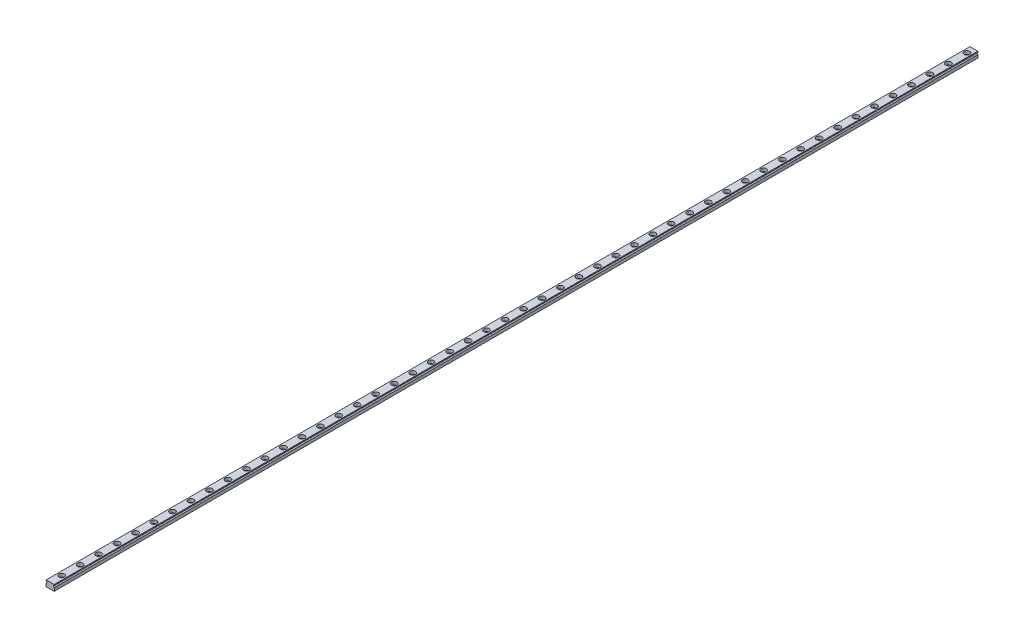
SolidWorks part; units mm, degrees
ref_plane "Front Plane" through (0, 0, 0) normal (0, 0, 1) x (1, 0, 0)
ref_plane "Top Plane" through (0, 0, 0) normal (0, 1, 0) x (1, 0, 0)
ref_plane "Right Plane" through (0, 0, 0) normal (1, 0, 0) x (0, 0, -1)
sketch "Sketch2" plane through (0, 0, 0) normal (0, 0, 1) x (1, 0, 0)
  line L0 (4.5, 1.8595) -> (4.5, 2.6595)
  line L1 (4.5, 2.6595) -> (4.3, 2.8595)
  line L2 (4.3, 2.8595) -> (-4.3, 2.8595)
  line L3 (-4.3, 2.8595) -> (-4.5, 2.6595)
  line L4 (-4.5, 2.6595) -> (-4.5, 1.8595)
  line L5 (-4.5, -0.1405) -> (-4.5, -3.4405)
  line L6 (-4.5, -3.4405) -> (-4.3, -3.6405)
  line L7 (-4.3, -3.6405) -> (0.2, -3.6405)
  line L8 (0.8, -3.6405) -> (4.3, -3.6405)
  line L9 (4.3, -3.6405) -> (4.5, -3.4405)
  line L10 (4.5, -3.4405) -> (4.5, -0.1405)
  line L11 (0.2, -3.6405) -> (0.8, -3.6405)
  arc A0 (3.5, 0.8595) -> (4.5, -0.1405) centre (4.5, 0.8595) ccw
  arc A1 (4.5, 1.8595) -> (3.5, 0.8595) centre (4.5, 0.8595) ccw
  arc A2 (-4.5, -0.1405) -> (-4.5, 1.8595) centre (-4.5, 0.8595) ccw
extrude "Boss-Extrude1" add sketch "Sketch2" along normal blind 1000
sketch "Sketch3" plane through (0, 2.8595, 0) normal (0, 1, 0) x (1, 0, 0)
  line L0 (4.5, -1000) -> (4.5, 0) construction
  line L2 (4.3, 0) -> (-4.3, 0) construction
  point P0 (0, -7.5)
  dimension "D1" = 4.5
  dimension "D2" = 7.5
hole_wizard "CBORE for M16 Hex Head Bolt1" positions "Sketch3" profile "Sketch4" counterbore size "M16" standard "DIN"
sketch "Sketch4" plane through (0, 2.8595, 7.5) normal (1, 0, 0) x (0, 0, 1)
  line L0 (0, 0) -> (0, 6.5)
  line L1 (0, 6.5) -> (1.75, 6.5)
  line L3 (1.75, 6.5) -> (1.75, 3.5)
  line L4 (1.75, 3.5) -> (3, 3.5)
  line L5 (3, 3.5) -> (3, 0)
  line L7 (3, 0) -> (0, 0)
  line L11 (0, -6.35) -> (0, 107.95) construction
  dimension "Thru Hole Dia." = 3.5
  dimension "Thru Hole Depth" = 6.5
  dimension "C'Bore Dia." = 6
  dimension "C'Bore Depth" = 3.5
other "Fill Pattern1" parameters "D5"=0, "D6"=0, "D1"=20, "D2"=60, "D3"=0, "D9"=50, "D7"=50, "D8"=2
